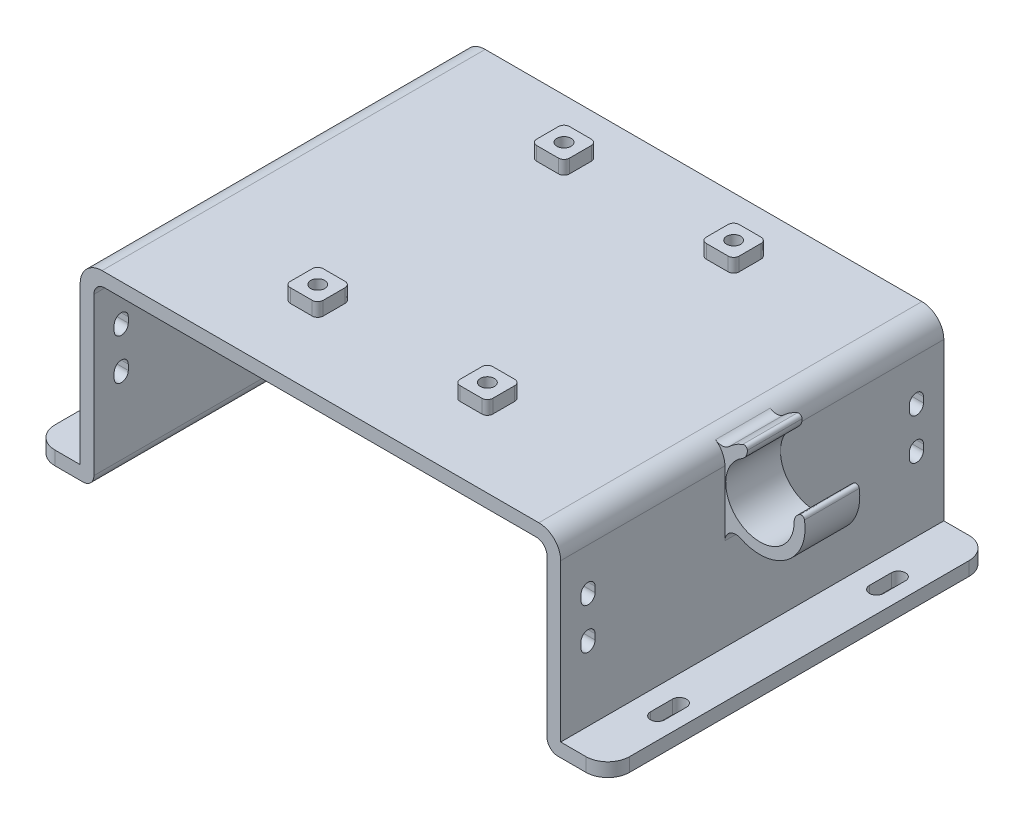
SolidWorks part; units mm, degrees
ref_plane "Front" through (0, 0, 0) normal (0, 0, 1) x (1, 0, 0)
ref_plane "Top" through (0, 0, 0) normal (0, 1, 0) x (1, 0, 0)
ref_plane "Right" through (0, 0, 0) normal (1, 0, 0) x (0, 0, -1)
sketch "Sketch2" plane through (0, 0, 0) normal (0, 0, 1) x (1, 0, 0)
  line L0 (0, -1000) -> (0, 49000) construction
  line L2 (-52.5653, 40.259) -> (52.5653, 40.259) construction
  line L3 (-52.5653, 40.259) -> (-52.5653, 0) construction
  line L4 (-52.5653, 0) -> (52.5653, 0) construction
  line L5 (52.5653, 40.259) -> (52.5653, 0) construction
  line L10 (-66.675, 0) -> (-66.675, 3.175)
  line L11 (-66.675, 3.175) -> (-55.753, 3.175)
  line L12 (-55.753, 3.175) -> (-55.753, 44.704)
  line L13 (-55.753, 44.704) -> (55.753, 44.704)
  line L14 (55.753, 44.704) -> (55.753, 3.175)
  line L15 (55.753, 3.175) -> (66.675, 3.175)
  line L16 (66.675, 3.175) -> (66.675, 0)
  line L17 (-66.675, 0) -> (-52.578, 0)
  line L18 (-52.578, 0) -> (-52.578, 41.529)
  line L19 (-52.578, 41.529) -> (52.578, 41.529)
  line L20 (52.578, 41.529) -> (52.578, 0)
  line L21 (52.578, 0) -> (66.675, 0)
  line L22 (-52.578, 41.529) -> (-55.753, 41.529) construction
  line L23 (-52.578, 41.529) -> (-52.578, 44.704) construction
  line L24 (52.578, 41.529) -> (55.753, 41.529) construction
  line L25 (-61.722, 10.3815) -> (-61.722, 0) construction
  line L26 (-64.5033, 10.3815) -> (-58.9407, 10.3815) construction
  line L27 (-64.5033, 10.3815) -> (-64.5033, 7.593) construction
  line L28 (-64.5033, 7.593) -> (-58.9407, 7.593) construction
  line L29 (-58.9407, 10.3815) -> (-58.9407, 7.593) construction
  point P7 (0, 0)
  point P13 (66.675, 1.5875)
  point P25 (0, 41.529)
  dimension "D1" = 105.1306
  dimension "D2" = 40.259
  dimension "D3" = 3.175
  dimension "D4" = 2.54
  dimension "D5" = 0.0254
  dimension "D6" = 133.35
  dimension "D7" = 5.5626
  dimension "D8" = 3.1877
  dimension "D9" = 123.444
sketch "Sketch3" plane through (0, 0, 0) normal (1, 0, 0) x (0, 0, -1)
  line L0 (0, 50) -> (0, -50) construction
  line L1 (-38.1, 29.845) -> (38.1, 29.845) construction
  line L2 (-38.1, 29.845) -> (-38.1, 20.32) construction
  line L3 (-38.1, 20.32) -> (38.1, 20.32) construction
  line L4 (38.1, 29.845) -> (38.1, 20.32) construction
  point P4 (0, 29.845)
  dimension "D1" = 76.2
  dimension "D2" = 9.525
  dimension "D3" = 20.32
extrude "Boss-Extrude1" add sketch "Sketch2" along normal mid plane 88.9
hole_wizard "#4 Clearance Slot1" positions "Sketch4" profile "Sketch5" size "#4" standard "ANSI Inch"
sketch "Sketch4" plane through (-55.753, 0, 0) normal (-1, 0, 0) x (0, 0, 1)
  line L0 (-38.1, 29.21) -> (-38.1, 30.48) construction
  point P0 (-38.1, 29.845)
  point P5 (-38.1, 20.32)
  point P8 (38.1, 20.32)
  point P11 (38.1, 29.845)
  dimension "D1" = 1.27
sketch "Sketch5" plane through (-55.753, 29.845, -38.1) normal (0, 1, 0) x (0, 0, 1)
  line L0 (0, 0) -> (0, 122.428)
  line L1 (0, 122.428) -> (1.6319, 122.428)
  line L2 (1.6319, 122.428) -> (1.6319, 0)
  line L5 (1.6319, 0) -> (0, 0)
  line L11 (0, -6.35) -> (0, 107.95) construction
  dimension "Thru Hole Dia." = 3.2639
  dimension "Thru Hole Depth" = 122.428
hole_wizard "#4 Clearance Slot2" positions "Sketch6" profile "Sketch7" size "#4" standard "ANSI Inch"
sketch "Sketch6" plane through (0, 0, 0) normal (0, 1, 0) x (1, 0, 0)
  line L1 (-61.722, 25.4) -> (61.722, 25.4) construction
  line L2 (-61.722, 25.4) -> (-61.722, -25.4) construction
  line L3 (-61.722, -25.4) -> (61.722, -25.4) construction
  line L4 (61.722, 25.4) -> (61.722, -25.4) construction
  line L5 (0, -50) -> (0, 50) construction
  line L6 (-50, 0) -> (50, 0) construction
  line L7 (-61.722, 27.94) -> (-61.722, 22.86) construction
  point P1 (-61.722, 25.4)
  point P2 (61.722, -25.4)
  point P151 (-61.722, -25.4)
  point P152 (61.722, 25.4)
  point P154 (0, 25.4)
  point P157 (-61.722, 0)
  dimension "D1" = 50.8
  dimension "D2" = 123.444
sketch "Sketch7" plane through (-61.722, 0, -25.4) normal (1, 0, 0) x (0, 0, -1)
  line L0 (0, 0) -> (0, 44.704)
  line L1 (0, 44.704) -> (1.6319, 44.704)
  line L2 (1.6319, 44.704) -> (1.6319, 0)
  line L5 (1.6319, 0) -> (0, 0)
  line L11 (0, -6.35) -> (0, 107.95) construction
  dimension "Thru Hole Dia." = 3.2639
  dimension "Thru Hole Depth" = 44.704
sketch "Sketch8" plane through (0, 0, 0) normal (0, 0, 1) x (1, 0, 0)
  line L0 (-55.753, 44.704) -> (55.753, 44.704) construction
  line L1 (-14.206, 44.704) -> (-6.586, 44.704)
  line L2 (-14.206, 44.704) -> (-14.206, 51.054)
  line L3 (-14.206, 51.054) -> (-6.586, 51.054)
  line L4 (-6.586, 44.704) -> (-6.586, 51.054)
  line L5 (-10.396, 51.054) -> (-10.396, 44.704) construction
  line L6 (6.586, 44.704) -> (14.206, 44.704)
  line L7 (6.586, 44.704) -> (6.586, 51.054)
  line L8 (6.586, 51.054) -> (14.206, 51.054)
  line L9 (14.206, 44.704) -> (14.206, 51.054)
  line L10 (10.396, 51.054) -> (10.396, 44.704) construction
  line L11 (-6.586, 51.054) -> (6.586, 51.054) construction
  line L12 (0, -50) -> (0, 50) construction
  point P16 (0, 51.054)
  dimension "D1" = 6.35
  dimension "D2" = 20.7919
  dimension "D3" = 0
  dimension "D4" = 7.62
sketch "Sketch9" plane through (0, 44.704, 0) normal (0, 1, 0) x (1, 0, 0)
  line L0 (-23.495, 27.94) -> (-15.875, 35.56) construction
  line L1 (-23.495, 35.56) -> (-15.875, 35.56)
  line L2 (-23.495, 35.56) -> (-23.495, 27.94)
  line L3 (-23.495, 27.94) -> (-15.875, 27.94)
  line L4 (-15.875, 35.56) -> (-15.875, 27.94)
  line L5 (15.875, 35.56) -> (23.495, 35.56)
  line L6 (15.875, 35.56) -> (15.875, 27.94)
  line L7 (15.875, 27.94) -> (23.495, 27.94)
  line L8 (23.495, 35.56) -> (23.495, 27.94)
  line L9 (-23.495, -21.59) -> (-15.875, -21.59)
  line L10 (-23.495, -21.59) -> (-23.495, -29.21)
  line L11 (-23.495, -29.21) -> (-15.875, -29.21)
  line L12 (-15.875, -21.59) -> (-15.875, -29.21)
  line L13 (15.875, -21.59) -> (23.495, -21.59)
  line L14 (15.875, -21.59) -> (15.875, -29.21)
  line L15 (15.875, -29.21) -> (23.495, -29.21)
  line L16 (23.495, -21.59) -> (23.495, -29.21)
  line L17 (-19.685, 31.75) -> (19.685, 31.75) construction
  line L18 (-19.685, 31.75) -> (-19.685, -25.4) construction
  line L19 (-19.685, -25.4) -> (19.685, -25.4) construction
  line L20 (19.685, 31.75) -> (19.685, -25.4) construction
  line L21 (15.875, 27.94) -> (23.495, 35.56) construction
  line L22 (-23.495, -29.21) -> (-15.875, -21.59) construction
  line L23 (15.875, -29.21) -> (23.495, -21.59) construction
  line L24 (0, -50) -> (0, 50) construction
  line L25 (55.753, 44.45) -> (-55.753, 44.45) construction
  line L27 (23.3512, 31.75) -> (21.5181, 34.925) construction
  line L28 (21.5181, 34.925) -> (17.8519, 34.925) construction
  line L29 (17.8519, 34.925) -> (16.0188, 31.75) construction
  line L30 (16.0188, 31.75) -> (17.8519, 28.575) construction
  line L31 (17.8519, 28.575) -> (21.5181, 28.575) construction
  line L32 (21.5181, 28.575) -> (23.3512, 31.75) construction
  circle A0 centre (-19.685, 31.75) radius 1.6319 construction
  circle A1 centre (19.685, 31.75) radius 3.175 construction
  point P26 (0, 31.75)
  dimension "D6" = 3.2639
  dimension "D1" = 0
  dimension "D2" = 39.37
  dimension "D3" = 57.15
  dimension "D4" = 7.62
  dimension "D5" = 12.7
  dimension "D7" = 6.35
extrude "Boss-Extrude2" add sketch "Sketch9" along normal blind 3.175
hole_wizard "#4 Clearance Hole1" positions "Sketch10" profile "Sketch11" hole size "#4" standard "ANSI Inch"
sketch "Sketch10" plane through (0, 41.529, 0) normal (0, -1, 0) x (-1, 0, 0)
  point P0 (-19.685, 31.75)
  point P5 (19.685, 31.75)
  point P8 (19.685, -25.4)
  point P11 (-19.685, -25.4)
sketch "Sketch11" plane through (19.685, 41.529, -31.75) normal (1, 0, 0) x (0, 0, -1)
  line L0 (0, 0) -> (0, 6.35)
  line L1 (0, 6.35) -> (1.6319, 6.35)
  line L2 (1.6319, 6.35) -> (1.6319, 0)
  line L5 (1.6319, 0) -> (0, 0)
  line L11 (0, -6.35) -> (0, 107.95) construction
  dimension "Thru Hole Dia." = 3.2639
  dimension "Thru Hole Depth" = 6.35
sketch "Sketch12" plane through (0, 41.529, 0) normal (0, -1, 0) x (1, 0, 0)
  line L1 (-15.8722, 25.4) -> (-17.7786, 28.702)
  line L2 (-17.7786, 28.702) -> (-21.5914, 28.702)
  line L3 (-21.5914, 28.702) -> (-23.4978, 25.4)
  line L4 (-23.4978, 25.4) -> (-21.5914, 22.098)
  line L5 (-21.5914, 22.098) -> (-17.7786, 22.098)
  line L6 (-17.7786, 22.098) -> (-15.8722, 25.4)
  line L7 (23.4978, 25.4) -> (21.5914, 28.702)
  line L8 (21.5914, 28.702) -> (17.7786, 28.702)
  line L9 (17.7786, 28.702) -> (15.8722, 25.4)
  line L10 (15.8722, 25.4) -> (17.7786, 22.098)
  line L11 (17.7786, 22.098) -> (21.5914, 22.098)
  line L12 (21.5914, 22.098) -> (23.4978, 25.4)
  line L13 (-17.7786, -28.448) -> (-21.5914, -28.448)
  line L14 (-21.5914, -28.448) -> (-23.4978, -31.75)
  line L15 (-23.4978, -31.75) -> (-21.5914, -35.052)
  line L16 (-21.5914, -35.052) -> (-17.7786, -35.052)
  line L17 (-17.7786, -35.052) -> (-15.8722, -31.75)
  line L18 (-15.8722, -31.75) -> (-17.7786, -28.448)
  line L19 (17.7786, -28.448) -> (15.8722, -31.75)
  line L20 (15.8722, -31.75) -> (17.7786, -35.052)
  line L21 (17.7786, -35.052) -> (21.5914, -35.052)
  line L22 (21.5914, -35.052) -> (23.4978, -31.75)
  line L23 (23.4978, -31.75) -> (21.5914, -28.448)
  line L24 (21.5914, -28.448) -> (17.7786, -28.448)
  circle A0 centre (-19.685, 25.4) radius 3.302 construction
  circle A1 centre (19.685, 25.4) radius 3.302 construction
  circle A2 centre (-19.685, -31.75) radius 3.302 construction
  circle A3 centre (19.685, -31.75) radius 3.302 construction
  dimension "D1" = 6.604
extrude "Cut-Extrude1" cut sketch "Sketch12" against normal blind 3.81
fillet "Fillet1" radius 2.54 4 edges at (52.578, 0, 0) (-52.578, 0, 0) (-52.578, 41.529, 0) (52.578, 41.529, 0)
fillet "Fillet2" radius 5.08 2 edges at (-55.753, 44.704, 0) (55.753, 44.704, 0)
fillet "Fillet3" radius 5.08 4 edges at (66.675, 1.5875, -44.45) (66.675, 1.5875, 44.45) (-66.675, 1.5875, 44.45) (-66.675, 1.5875, -44.45)
fillet "Fillet4" radius 1.27 16 edges at (15.875, 46.2915, 29.21) (23.495, 46.2915, 29.21) (15.875, 46.2915, 21.59) (-23.495, 46.2915, 29.21) (-15.875, 46.2915, 29.21) (-15.875, 46.2915, 21.59) (-23.495, 46.2915, 21.59) (15.875, 46.2915, -27.94) (23.495, 46.2915, -27.94) (23.495, 46.2915, -35.56) (15.875, 46.2915, -35.56) (-23.495, 46.2915, -35.56) (-15.875, 46.2915, -35.56) (-15.875, 46.2915, -27.94) (-23.495, 46.2915, -27.94) (23.495, 46.2915, 21.59)
sketch "Sketch13" plane through (0, 0, 0) normal (0, 0, 1) x (1, 0, 0)
  line L1 (63.8775, 36.3348) -> (63.8775, 28.3973) construction
  line L2 (-55.753, 44.704) -> (55.753, 44.704) construction
  line L4 (61.0009, 43.7327) -> (60.9429, 46.393)
  line L5 (63.8775, 36.3348) -> (61.0009, 43.7327) construction
  line L6 (63.8775, 36.3348) -> (71.6945, 37.7132) construction
  line L7 (71.6945, 37.7132) -> (73.9988, 39.0436)
  arc A0 (61.0009, 43.7327) -> (71.6945, 37.7132) centre (63.8775, 36.3348) ccw
  arc A1 (60.9429, 46.393) -> (73.9988, 39.0436) centre (63.8775, 36.3348) ccw
  arc A2 (73.9988, 39.0436) -> (60.9429, 46.393) centre (63.8775, 36.3348) ccw construction
  arc A3 (71.6945, 37.7132) -> (61.0009, 43.7327) centre (63.8775, 36.3348) ccw construction
  point P1 (63.8775, 36.3348)
  dimension "D1" = 15.875
  dimension "D2" = 2.54
  dimension "D3" = 16.3067
  dimension "D4" = 101.248
  dimension "D5" = 100
  dimension "D6" = 160
  dimension "D7" = 160
  dimension "D8" = 8.1245
extrude "Boss-Extrude3" add sketch "Sketch13" along normal mid plane 12.7
fillet "Fillet6" radius 2.54 4 edges at (55.1179, 42.0835, 0) (61.0009, 43.7327, 0) (71.6945, 37.7132, 0) (55.753, 29.719, 0)
fillet "Fillet7" radius 0.762 2 edges at (73.9988, 39.0436, 0) (60.9429, 46.393, 0)
